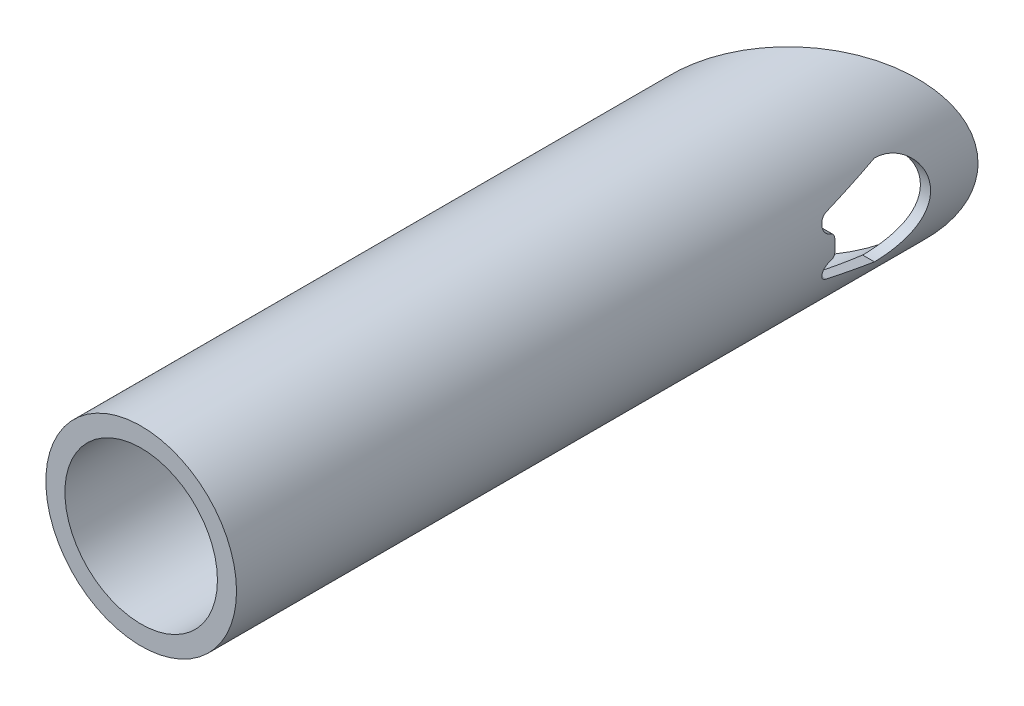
SolidWorks part; units mm, degrees
ref_plane "Front Plane" through (0, 0, 0) normal (0, 0, 1) x (1, 0, 0)
ref_plane "Top Plane" through (0, 0, 0) normal (0, 1, 0) x (1, 0, 0)
ref_plane "Right Plane" through (0, 0, 0) normal (1, 0, 0) x (0, 0, -1)
sketch "Sketch1" plane through (0, 0, 0) normal (0, 0, 1) x (1, 0, 0)
  circle A0 centre (0, 0) radius 14.2875
  circle A1 centre (0, 0) radius 12.7635
  dimension "D1" = 28.575
  dimension "D2" = 1.524
extrude "Boss-Extrude1" add sketch "Sketch1" along normal blind 111.125
sketch "Sketch2" plane through (0, 0, 0) normal (0, 1, 0) x (1, 0, 0)
  line L0 (14.2875, 0) -> (-14.2875, -25.4)
  line L1 (-14.2875, 0) -> (-14.2875, -111.125) construction
  line L2 (-14.2875, -25.4) -> (-14.2875, 0)
  line L3 (14.2875, 0) -> (-14.2875, 0) construction
  line L4 (-14.2875, 0) -> (14.2875, 0)
  dimension "D1" = 25.4
extrude "Cut-Extrude1" cut sketch "Sketch2" against normal through all and the other way through all
sketch "Sketch3" plane through (0, 0, 111.125) normal (0, 0, 1) x (1, 0, 0)
  circle A0 centre (0, 0) radius 14.2875
  circle A1 centre (0, 0) radius 11.43
  circle A2 centre (0, 0) radius 14.2875 construction
  dimension "D1" = 22.86
extrude "Boss-Extrude2" add sketch "Sketch3" against normal blind 76.2
sketch "Sketch4" plane through (0, 0, 34.925) normal (0, 0, -1) x (-1, 0, 0)
  circle A0 centre (0, 0) radius 12.7635
  circle A1 centre (0, 0) radius 12.7635 construction
extrude "Boss-Extrude3" add sketch "Sketch4" against normal blind 5.08
sketch "Sketch5" plane through (0, 0, 0) normal (1, 0, 0) x (0, 0, -1)
  line L0 (0, 0) -> (-22.2766, 0) construction
  line L1 (-22.2766, 0) -> (-22.2766, 1.8818) construction
  line L2 (-22.097, 4.3434) -> (-13.8438, 6.7366)
  line L3 (-22.2766, 0) -> (-22.2766, -1.8818) construction
  line L4 (-22.097, -4.3434) -> (-13.8438, -6.7366)
  line L5 (-13.8438, -6.7366) -> (-13.8438, 6.7366) construction
  line L6 (-21.4337, 1.4974) -> (-21.4337, 0)
  line L7 (-21.4337, 0) -> (-21.4337, -1.4974)
  line L8 (-21.4337, 1.4974) -> (-22.2766, 1.8818)
  line L9 (-21.4337, -1.4974) -> (-22.2766, -1.8818)
  line L10 (-22.097, -4.3434) -> (-22.097, 4.3434) construction
  arc A0 (-13.8438, 6.7366) -> (-13.8438, -6.7366) centre (-13.8438, 0) cw
  arc A1 (-22.097, 4.3434) -> (-22.2766, 1.8818) centre (-21.7304, 3.0793) ccw
  arc A2 (-22.097, -4.3434) -> (-22.2766, -1.8818) centre (-21.7304, -3.0793) cw
  dimension "D1" = 13.4733
extrude "Cut-Extrude2" cut sketch "Sketch5" along normal through all
sketch "Sketch6" [suppressed] plane through (0, 0, 111.125) normal (0, 0, 1) x (1, 0, 0)
  circle A1 centre (0, 0) radius 14.2875
  circle A2 centre (0, 0) radius 14.2875
  dimension "D1" = 0
extrude "Cut-Extrude3" [suppressed] cut sketch "Sketch6" against normal blind 25.4
fillet "Fillet1" radius 0.762 2 edges at (13.4421, -1.4974, 21.4337) (13.4421, 1.4974, 21.4337)
